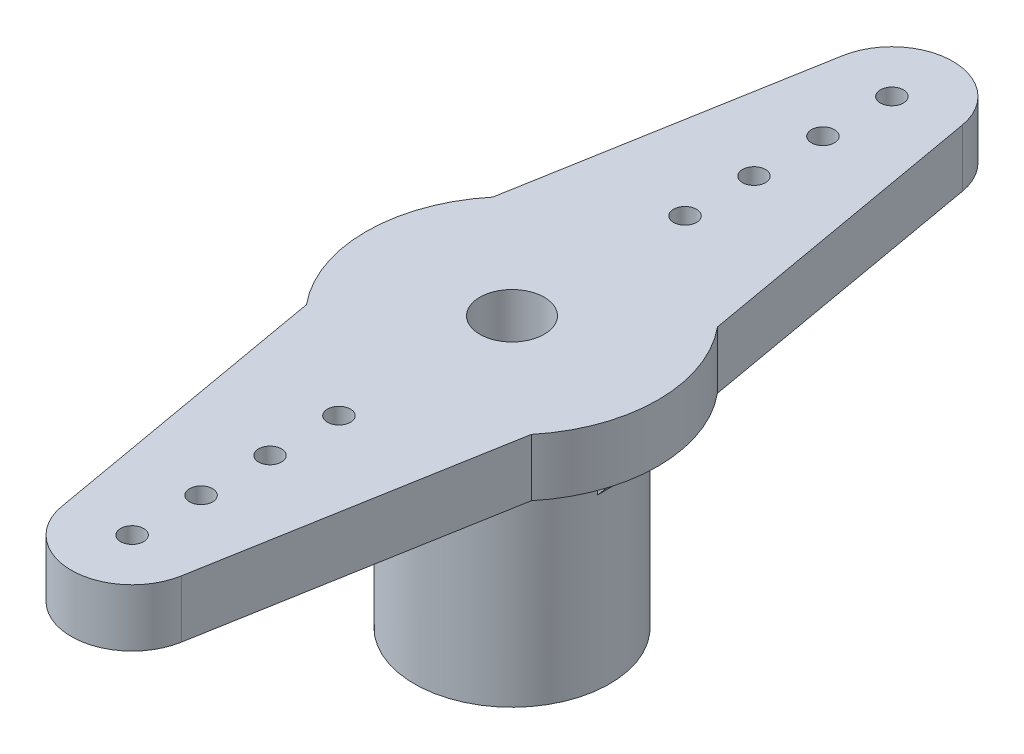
SolidWorks part; units mm, degrees
ref_plane "Front Plane" through (0, 0, 0) normal (0, 0, 1) x (1, 0, 0)
ref_plane "Top Plane" through (0, 0, 0) normal (0, 1, 0) x (1, 0, 0)
ref_plane "Right Plane" through (0, 0, 0) normal (1, 0, 0) x (0, 0, -1)
sketch "Sketch1" plane through (0, 0, 0) normal (0, 1, 0) x (1, 0, 0)
  circle A0 centre (0, 0) radius 6.35
  dimension "D1" = 12.7
extrude "Boss-Extrude1" add sketch "Sketch1" along normal blind 11.75
sketch "Sketch2" plane through (0, 11.75, 0) normal (0, 1, 0) x (1, 0, 0)
  line L0 (0, 0) -> (0, 16.53) construction
  line L1 (-2.6097, 16.9902) -> (-4.8916, 4.049)
  line L2 (0, 19.18) -> (0, 16.53) construction
  line L3 (2.6097, 16.9902) -> (4.8916, 4.049)
  arc A0 (2.6097, 16.9902) -> (-2.6097, 16.9902) centre (0, 16.53) ccw
  arc A4 (4.8916, 4.049) -> (-4.8916, 4.049) centre (0, 0) ccw
  circle A5 centre (0, 0) radius 6.35 construction
  dimension "D1" = 5.3
  dimension "D2" = 19.18
  dimension "D3" = 10
  dimension "D4" = 9.7832
extrude "horn" add sketch "Sketch2" against normal blind 2.5
sketch "Sketch4" plane through (0, 11.75, 0) normal (0, -1, 0) x (-1, 0, 0)
  circle A0 centre (0, 0) radius 1.4
  dimension "D1" = 2.8
extrude "Cut-Extrude1" cut sketch "Sketch4" along normal through all
sketch "Sketch5" plane through (0, 0, 0) normal (0, -1, 0) x (-1, 0, 0)
  circle A0 centre (0, 16.53) radius 0.5
  dimension "D1" = 1
extrude "Cut-Extrude2" cut sketch "Sketch5" against normal through all
sketch "Sketch6" plane through (0, 0, 0) normal (0, 1, 0) x (1, 0, 0)
  line L0 (0, 0) -> (0, 16.53) construction
pattern_linear "LPattern1" count 4 spacing 3 along (0, 0, 1) of "Cut-Extrude2"
mirror "Mirror1" about plane through (0, 0, 0) normal (0, 0, 1) of "horn", "LPattern1", "Cut-Extrude2"
sketch "Sketch8" plane through (0, 0, 0) normal (0, -1, 0) x (-1, 0, 0)
  line L0 (0, -2.9) -> (0.2629, -2.5867)
  line L1 (0, -2.9) -> (-0.2629, -2.5867)
  line L2 (0, -2.6) -> (0, -2.9) construction
  line L3 (0, 0) -> (0, -2.6) construction
  arc A1 (-0.2629, -2.5867) -> (0.2629, -2.5867) centre (0, 0) ccw
  dimension "D1" = 0.3
  dimension "D2" = 5.2
  dimension "D3" = 80
extrude "Cut-Extrude4" cut sketch "Sketch8" against normal blind 3
pattern_circular "CirPattern2" count 26 over 360 about axis through (0, 0, 0) along (0, 1, 0) of "Cut-Extrude4"
sketch "Sketch9" plane through (0, 0, 0) normal (0, -1, 0) x (-1, 0, 0)
  circle A0 centre (0, 0) radius 2.6
  arc A1 (-0.2629, -2.5867) -> (0.2629, -2.5867) centre (0, 0) ccw construction
extrude "Cut-Extrude5" cut sketch "Sketch9" against normal blind 3
sketch "Sketch10" plane through (0, 0, 0) normal (0, -1, 0) x (-1, 0, 0)
  circle A0 centre (0, 0) radius 6.35
  circle A1 centre (0, 0) radius 4.25
  circle A2 centre (0, 0) radius 6.35 construction
  dimension "D1" = 8.5
extrude "Cut-Extrude6" cut sketch "Sketch10" against normal up to surface (9.25 mm away)
sketch "Sketch11" plane through (0, 0, 0) normal (0, 0, 1) x (1, 0, 0)
  line L2 (4.21, 7.34) -> (5.8127, 9.25)
  line L3 (4.8916, 9.25) -> (6.35, 9.25) construction
  line L4 (5.8127, 9.25) -> (4.21, 9.25)
  line L7 (4.21, 7.34) -> (4.16, 7.34)
  line L8 (4.16, 7.34) -> (4.16, 9.25)
  line L10 (4.21, 7.34) -> (4.21, 9.25) construction
  line L12 (4.16, 9.25) -> (4.21, 9.25)
  line L13 (0, 9.25) -> (4.16, 9.25) construction
  line L14 (-4.25, 9.25) -> (4.25, 9.25) construction
  dimension "D1" = 1.91
  dimension "D2" = 0.05
  dimension "D3" = 40
  dimension "D4" = 4.16
extrude "Boss-Extrude5" add sketch "Sketch11" along normal mid plane 1
pattern_circular "CirPattern3" count 4 over 360 about axis through (0, 0, 0) along (0, 1, 0) of "Boss-Extrude5"
sketch "Sketch12" plane through (0, 11.75, 0) normal (0, 1, 0) x (1, 0, 0)
  circle A0 centre (0, 0) radius 4.375
  dimension "D1" = 8.75
